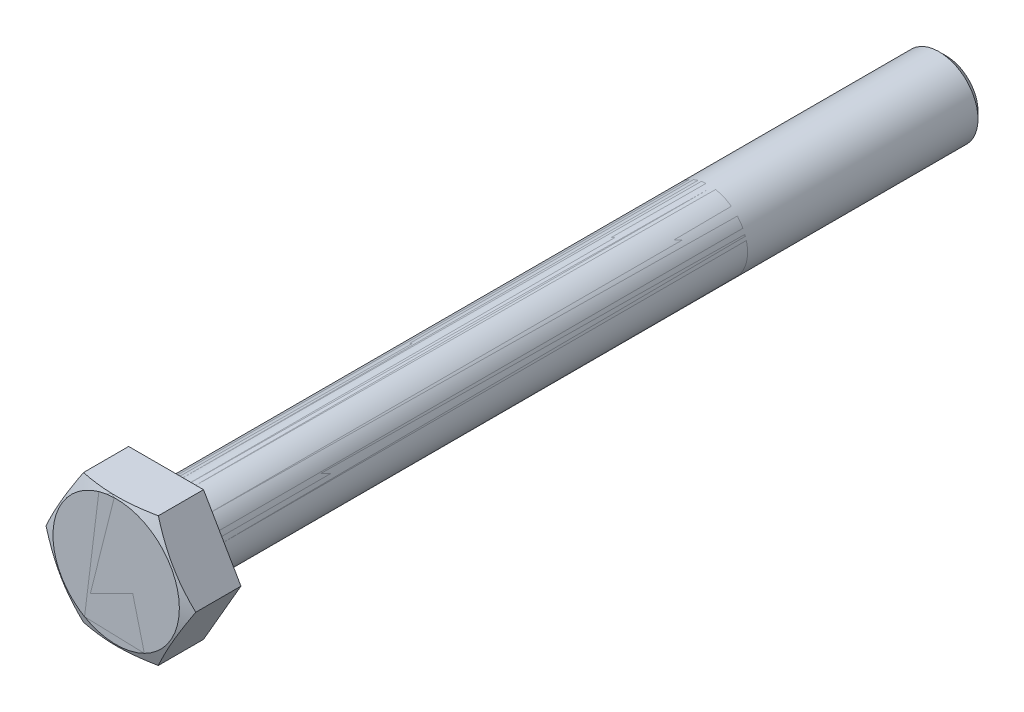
SolidWorks part; units mm, degrees
ref_plane "Face" through (0, 0, 0) normal (0, 0, 1) x (1, 0, 0)
ref_plane "Dessus" through (0, 0, 0) normal (0, 1, 0) x (1, 0, 0)
ref_plane "Droite" through (0, 0, 0) normal (1, 0, 0) x (0, 0, -1)
imported_body "Vis H - Tige normale DIN 931 - M6x60 - 5,6"
sketch "Esquisse1" plane through (0, 0, -42) normal (0, 0, 1) x (1, 0, 0)
  circle A0 centre (0, 0) radius 3 construction
  circle A1 centre (0, 0) radius 3
extrude "Boss.-Extru.1" add sketch "Esquisse1" along normal up to next
